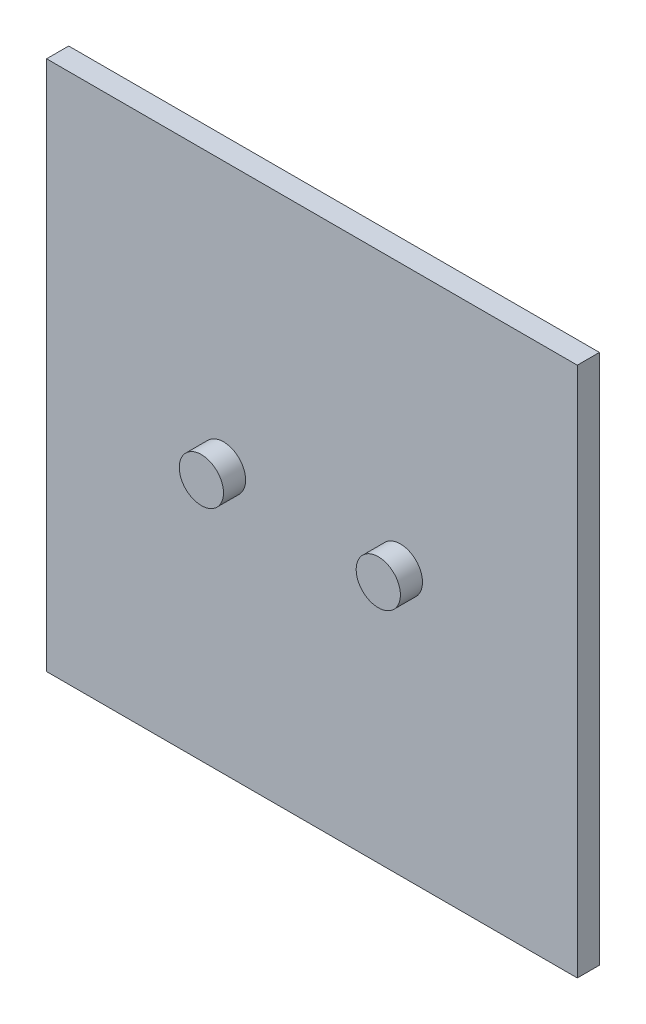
SolidWorks part; units mm, degrees
ref_plane "Front Plane" through (0, 0, 0) normal (0, 0, 1) x (1, 0, 0)
ref_plane "Top Plane" through (0, 0, 0) normal (0, 1, 0) x (1, 0, 0)
ref_plane "Right Plane" through (0, 0, 0) normal (1, 0, 0) x (0, 0, -1)
sketch "Sketch1" plane through (0, 0, 0) normal (0, 0, 1) x (1, 0, 0)
  line L1 (0, 0) -> (76.2, 0)
  line L2 (0, 0) -> (0, 76.2)
  line L3 (0, 76.2) -> (76.2, 76.2)
  line L4 (76.2, 0) -> (76.2, 76.2)
  dimension "D1" = 76.2
  dimension "D2" = 76.2
extrude "Extrude1" add sketch "Sketch1" along normal blind 3.175
sketch "Sketch2" plane through (0, 0, 3.175) normal (0, 0, 1) x (1, 0, 0)
  line L0 (38.1, 90.5876) -> (38.1, -8.3949) construction
  line L1 (-10.8746, 38.1) -> (89.761, 38.1) construction
  line L2 (76.2, 76.2) -> (0, 76.2) construction
  line L3 (0, 76.2) -> (0, 0) construction
  circle A0 centre (25.4, 38.1) radius 3.175
  circle A1 centre (50.8, 38.1) radius 3.175
  point P10 (38.1, 76.2)
  point P11 (39.4432, 38.1)
  point P14 (0, 38.1)
  dimension "D3" = 6.35
  dimension "D1" = 25.4
  dimension "D2" = 12.7
extrude "Extrude2" add sketch "Sketch2" along normal blind 3.175
